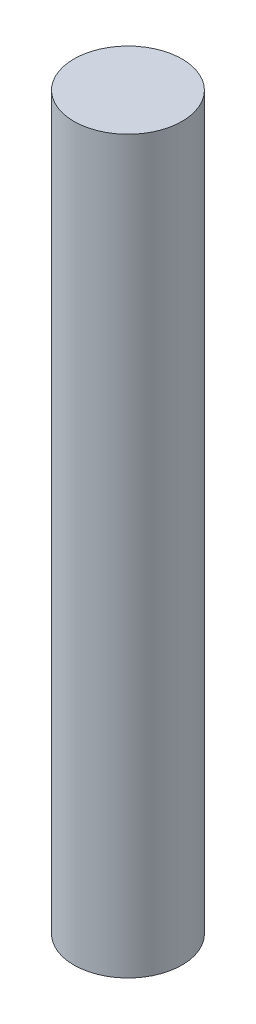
SolidWorks part; units mm, degrees
ref_plane "Front Plane" through (0, 0, 0) normal (0, 0, 1) x (1, 0, 0)
ref_plane "Top Plane" through (0, 0, 0) normal (0, 1, 0) x (1, 0, 0)
ref_plane "Right Plane" through (0, 0, 0) normal (1, 0, 0) x (0, 0, -1)
sketch "Sketch1" plane through (0, 0, 0) normal (0, 1, 0) x (1, 0, 0)
  circle A0 centre (0, 0) radius 1.85
  dimension "D1" = 3.7
extrude "Boss-Extrude1" add sketch "Sketch1" along normal blind 25
